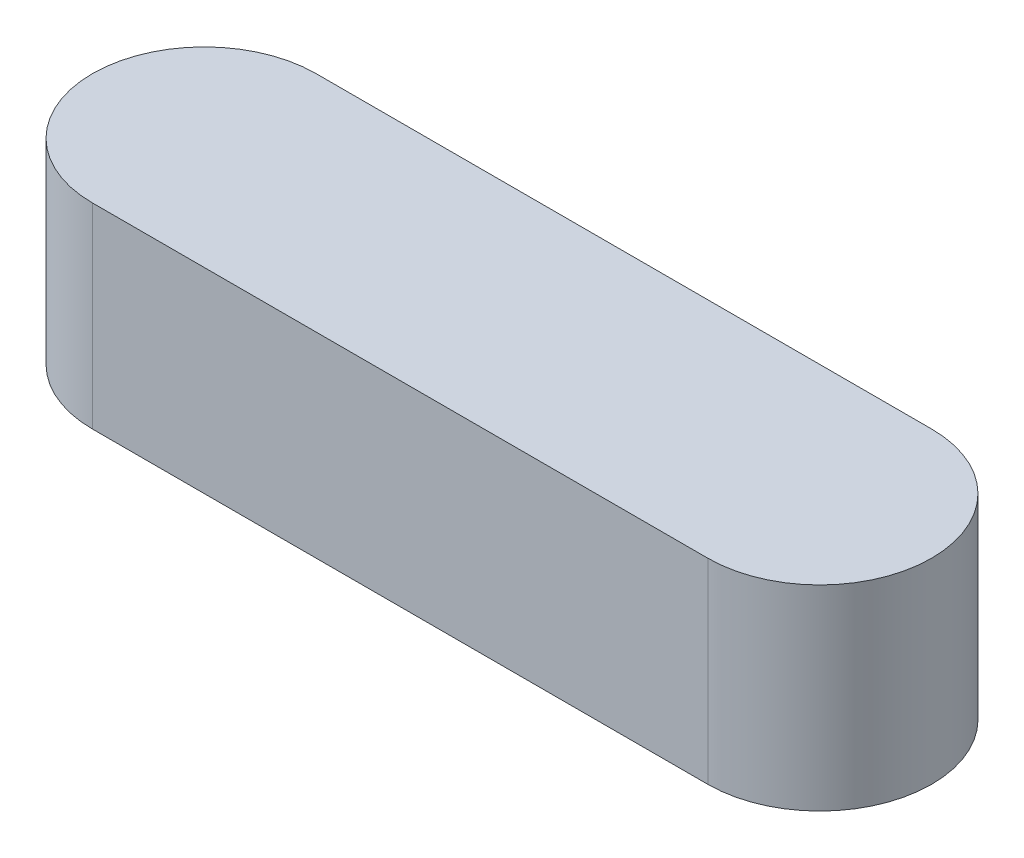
SolidWorks part; units mm, degrees
ref_plane "Plan1" through (0, 0, 0) normal (0, 0, 1) x (1, 0, 0)
ref_plane "Plan2" through (0, 0, 0) normal (0, 1, 0) x (1, 0, 0)
ref_plane "Plan3" through (0, 0, 0) normal (1, 0, 0) x (0, 0, -1)
sketch "Esquisse1" plane through (0, 0, 0) normal (0, 1, 0) x (1, 0, 0)
  line L0 (0, 4) -> (22, 4)
  line L1 (0, -4) -> (22, -4)
  arc A0 (0, 4) -> (0, -4) centre (0, 0) ccw
  arc A1 (22, -4) -> (22, 4) centre (22, 0) ccw
  dimension "D1" = 4
  dimension "D2" = 4
  dimension "D3" = 22
extrude "Base-Extrusion" add sketch "Esquisse1" along normal blind 7
